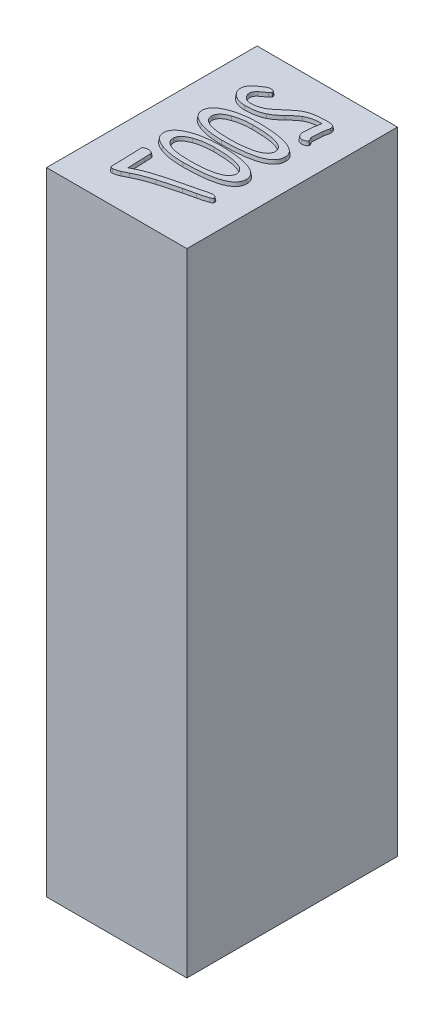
SolidWorks part; units mm, degrees
ref_plane "Plan de face" through (0, 0, 0) normal (0, 0, 1) x (1, 0, 0)
ref_plane "Plan de dessus" through (0, 0, 0) normal (0, 1, 0) x (1, 0, 0)
ref_plane "Plan de droite" through (0, 0, 0) normal (1, 0, 0) x (0, 0, -1)
sketch "Esquisse1" plane through (0, 0, 0) normal (0, 0, 1) x (1, 0, 0)
  line L1 (-2, 0) -> (2, 0)
  line L2 (-2, 0) -> (-2, 18)
  line L3 (-2, 18) -> (2, 18)
  line L4 (2, 0) -> (2, 18)
  point P5 (0, 0)
  dimension "D1" = 18
  dimension "D2" = 4
extrude "Extrusion1" add sketch "Esquisse1" along normal mid plane 6
sketch "Esquisse3" plane through (0, 18, 0) normal (0, 1, 0) x (-1, 0, 0)
  line L0 (-1.2, -3) -> (-1.2, 3) construction
  line L1 (-2, -3) -> (2, -3) construction
  line L2 (-2, 3) -> (2, 3) construction
  line L3 (-2, 3) -> (-2, -3) construction
  text T0 "2007" font "Comic Sans MS" height in points 8
  dimension "D1" = 0.8
extrude "Extrusion3" add sketch "Esquisse3" along normal blind 0.1 draft 10
